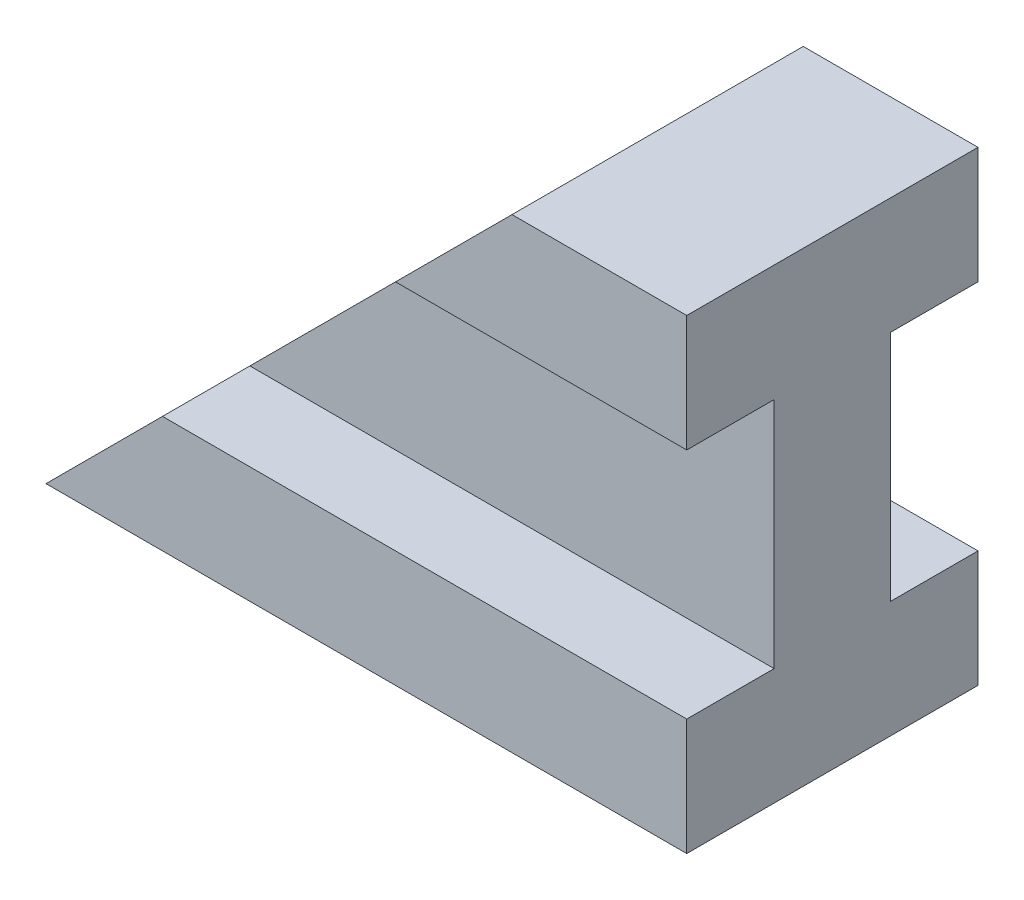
SolidWorks part; units mm, degrees
ref_plane "前视基准面" through (0, 0, 0) normal (0, 0, 1) x (1, 0, 0)
ref_plane "上视基准面" through (0, 0, 0) normal (0, 1, 0) x (1, 0, 0)
ref_plane "右视基准面" through (0, 0, 0) normal (1, 0, 0) x (0, 0, -1)
sketch "草图1" plane through (0, 0, 0) normal (0, 0, 1) x (1, 0, 0)
  line L0 (0, 0) -> (110, 0)
  line L1 (110, 0) -> (110, 80)
  line L2 (110, 80) -> (80, 80)
  line L3 (80, 80) -> (0, 0)
  dimension "D1" = 30
  dimension "D2" = 80
  dimension "D3" = 80
extrude "拉伸1" add sketch "草图1" along normal blind 50
sketch "草图2" plane through (110, 0, 0) normal (1, 0, 0) x (0, 0, -1)
  line L0 (-25, 80) -> (-25, 48.0986) construction
  line L1 (-50, 80) -> (0, 80) construction
  line L2 (-50, 0) -> (-50, 80) construction
  line L3 (-50, 60) -> (-35, 60)
  line L4 (-50, 60) -> (-50, 20)
  line L5 (-50, 20) -> (-35, 20)
  line L6 (-35, 60) -> (-35, 20)
  line L7 (-50, 0) -> (0, 0) construction
  line L8 (-15, 60) -> (-15, 20)
  line L9 (0, 20) -> (-15, 20)
  line L10 (0, 60) -> (0, 20)
  line L11 (0, 60) -> (-15, 60)
  dimension "D1" = 20
  dimension "D2" = 20
  dimension "D3" = 20
extrude "切除-拉伸1" cut sketch "草图2" against normal through all
